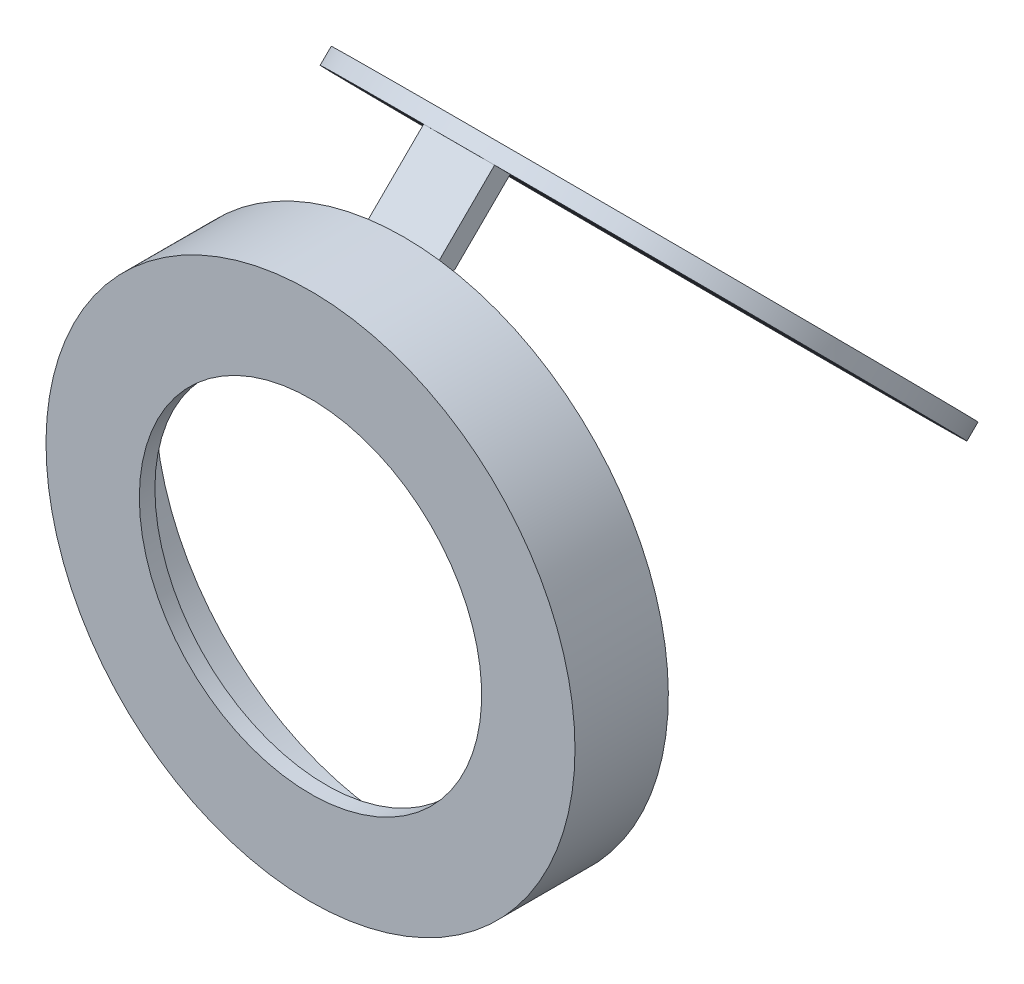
SolidWorks part; units mm, degrees
other "Basis-Linear austragen"
ref_plane "Plan de face" through (0, 0, 0) normal (0, 0, 1) x (1, 0, 0)
ref_plane "Plan de dessus" through (0, 0, 0) normal (0, 1, 0) x (1, 0, 0)
ref_plane "Plan de droite" through (0, 0, 0) normal (1, 0, 0) x (0, 0, -1)
imported_body "Importée1"
sketch "Esquisse1" plane through (0, 0, 0) normal (0, 0, -1) x (-1, 0, 0)
  circle A0 centre (0, 0) radius 17
  circle A1 centre (0, 0) radius 13.75 construction
  circle A2 centre (0, 0) radius 13.75
  dimension "D1" = 34
extrude "Boss.-Extru.1" add sketch "Esquisse1" against normal up to surface (1 mm away)
sketch "Esquisse2" plane through (0, 0, 0) normal (0, 0, -1) x (-1, 0, 0)
  circle A0 centre (0, 0) radius 16
  circle A1 centre (0, 0) radius 17
  circle A2 centre (0, 0) radius 17
  dimension "D2" = 1
  dimension "D1" = 0
extrude "Boss.-Extru.2" add sketch "Esquisse2" along normal blind 5
sketch "Esquisse3" plane through (0, 0, -5) normal (0, 0, -1) x (-1, 0, 0)
  line L1 (-2.2799, 16.8464) -> (2.2799, 16.8464)
  line L2 (-2.2799, 16.8464) -> (-2.2799, 15.8367)
  line L3 (-2.2799, 15.8367) -> (2.2799, 15.8367)
  line L4 (2.2799, 16.8464) -> (2.2799, 15.8367)
  line L5 (-2.2799, 16.8464) -> (2.2799, 15.8367) construction
  line L6 (-2.2799, 15.8367) -> (2.2799, 16.8464) construction
  circle A2 centre (0, 0) radius 16 construction
  circle A3 centre (0, 0) radius 16 construction
  circle A4 centre (0, 0) radius 17 construction
  point P0 (0, 16.3416)
extrude "Boss.-Extru.3" add sketch "Esquisse3" along normal blind 1
sketch "Esquisse4" plane through (2.2799, 0, 0) normal (1, 0, 0) x (0, 0, -1)
  line L0 (6, 16.8464) -> (6, 15.8367) construction
  line L1 (6, 16.8464) -> (6, 15.8367)
  line L2 (6, 16.8464) -> (5, 16.8464) construction
  line L3 (6, 16.8464) -> (5, 16.8464)
  line L4 (6, 15.8367) -> (5, 16.8464)
extrude "Enlèv. mat.-Extru.1" cut sketch "Esquisse4" against normal up to next
sketch "Esquisse5" plane through (0, 10.8418, -10.9469) normal (0, 0.7037, -0.7105) x (-1, 0, 0)
  line L4 (2.2799, 7.03) -> (2.2799, 8.4511)
  line L5 (2.2799, 8.4511) -> (-2.2799, 8.4511)
  line L6 (-2.2799, 8.4511) -> (-2.2799, 7.03)
  line L7 (-2.2799, 7.03) -> (2.2799, 7.03)
  line L8 (2.2799, 7.03) -> (2.2799, 8.4511)
  line L9 (2.2799, 8.4511) -> (-2.2799, 8.4511)
  line L10 (-2.2799, 8.4511) -> (-2.2799, 7.03)
  line L11 (-2.2799, 7.03) -> (2.2799, 7.03)
  dimension "D1" = 0
extrude "Boss.-Extru.4" add sketch "Esquisse5" along normal blind 5
sketch "Esquisse6" plane through (0, 14.3603, -14.4995) normal (0, 0.7037, -0.7105) x (-1, 0, 0)
  circle A0 centre (0, -8.3953) radius 17
  dimension "D1" = 34
extrude "Boss.-Extru.5" add sketch "Esquisse6" along normal blind 1
